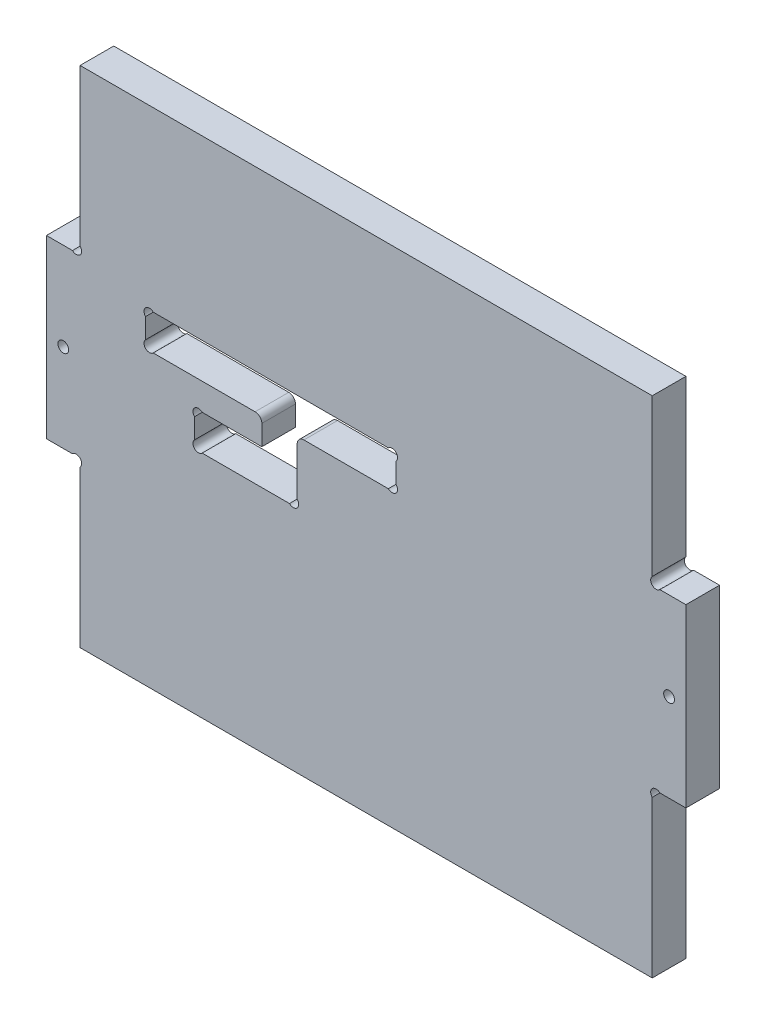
SolidWorks part; units mm, degrees
ref_plane "Plan de face" through (0, 0, 0) normal (0, 0, 1) x (1, 0, 0)
ref_plane "Plan de dessus" through (0, 0, 0) normal (0, 1, 0) x (1, 0, 0)
ref_plane "Plan de droite" through (0, 0, 0) normal (1, 0, 0) x (0, 0, -1)
sketch "Esquisse1" plane through (0, 0, 0) normal (0, 0, 1) x (1, 0, 0)
  line L0 (95, 41.9079) -> (95, 51.9079)
  line L1 (-20.5, -29.7114) -> (-29.2069, -21.2314) construction
  line L2 (-95, 41.9079) -> (-95, -97.9114)
  line L3 (-95, -97.9114) -> (95, -97.9114)
  line L4 (95, 41.9079) -> (95, -97.9114)
  line L7 (-31, -0.7114) -> (-20.5, -0.7114)
  line L8 (-31, -0.7114) -> (-31, -29.7114)
  line L9 (-31, -29.7114) -> (-22.7924, -29.7114)
  line L10 (-20.5, -0.7114) -> (-20.5, -27.4788)
  line L13 (0, 68.0403) -> (0, -120.1787) construction
  line L17 (95, 51.9079) -> (-95, 51.9079)
  line L18 (-95, 41.9079) -> (-95, 51.9079)
  arc A0 (-22.7924, -29.7114) -> (-20.5, -27.4788) centre (-21.6462, -28.5951) ccw
  point P0 (0, 0)
  point P14 (-21.6462, -28.5951)
  dimension "D1" = 190
  dimension "D2" = 139.8194
  dimension "D3" = 10.5
  dimension "D4" = 64
  dimension "D5" = 1.6
  dimension "D6" = 29
  dimension "D7" = 68.2
extrude "Boss.-Extru.1" add sketch "Esquisse1" along normal blind 10
sketch "Esquisse14" plane through (0, 0, 10) normal (0, 0, 1) x (1, 0, 0)
  line L0 (0, 106.416) -> (0, -108.7689) construction
  line L1 (95, -23.0018) -> (-170.2302, -23.0018) construction
  line L2 (95, -97.9114) -> (95, 51.9079) construction
  line L3 (85, 2.7465) -> (98.9726, 16.7191) construction
  line L4 (-85, 2.7465) -> (-98.9726, 16.7191) construction
  line L5 (85, 51.9079) -> (85, 5.4207)
  line L6 (-85, -48.75) -> (-98.9726, -62.7226) construction
  line L7 (-85, -97.9114) -> (-85, -51.4242)
  line L8 (-95, -49.1614) -> (-87.2627, -49.1614)
  line L9 (-95, -97.9114) -> (-95, -49.1614)
  line L10 (-95, -97.9114) -> (-85, -97.9114)
  line L11 (95, 3.1579) -> (87.2627, 3.1579)
  line L12 (85, -48.75) -> (98.9726, -62.7226) construction
  line L13 (95, -97.9114) -> (85, -97.9114)
  line L14 (95, -97.9114) -> (95, -49.1614)
  line L15 (95, -49.1614) -> (87.2627, -49.1614)
  line L16 (85, -97.9114) -> (85, -51.4242)
  line L17 (95, 51.9079) -> (95, 3.1579)
  line L18 (95, 51.9079) -> (85, 51.9079)
  line L19 (-95, 51.9079) -> (-85, 51.9079)
  line L20 (-95, 51.9079) -> (-95, 3.1579)
  line L21 (-95, 3.1579) -> (-87.2627, 3.1579)
  line L22 (-85, 51.9079) -> (-85, 5.4207)
  line L23 (95, 51.9079) -> (-95, 51.9079) construction
  arc A0 (85, 5.4207) -> (87.2627, 3.1579) centre (86.1314, 4.2893) ccw
  arc A1 (-85, -51.4242) -> (-87.2627, -49.1614) centre (-86.1314, -50.2928) ccw
  arc A2 (85, -51.4242) -> (87.2627, -49.1614) centre (86.1314, -50.2928) cw
  arc A3 (-85, 5.4207) -> (-87.2627, 3.1579) centre (-86.1314, 4.2893) cw
  dimension "D1" = 0
extrude "Enlèv. mat.-Extru.9" cut sketch "Esquisse14" against normal through all
sketch "Esquisse16" plane through (0, 0, 10) normal (0, 0, 1) x (1, 0, 0)
  line L0 (-58.2793, -0.7114) -> (-63.2773, -0.7114)
  line L1 (-70.54, -5.9614) -> (19.2239, -5.9614) construction
  line L2 (-20.5, -0.7114) -> (6.5833, -0.7114)
  line L3 (-20.5, -0.7114) -> (-20.5, -11.2114)
  line L4 (-20.5, -11.2114) -> (6.5833, -11.2114)
  line L5 (8.84, -2.9802) -> (8.84, -8.9427)
  line L6 (-31, -0.7114) -> (-58.2793, -0.7114)
  line L7 (-31, -0.7114) -> (-31, -11.2114)
  line L8 (-31, -11.2114) -> (-58.2793, -11.2114)
  line L9 (-65.54, -2.9742) -> (-65.54, -8.9487)
  line L10 (-65.54, -11.2114) -> (-61.8893, -7.5607) construction
  line L11 (8.84, -11.2114) -> (5.7464, -8.1013) construction
  line L12 (-58.2793, -11.2114) -> (-63.2773, -11.2114)
  line L14 (-65.54, -0.7114) -> (-63.2773, -2.9742) construction
  arc A0 (-63.2773, -0.7114) -> (-65.54, -2.9742) centre (-64.4086, -1.8428) ccw
  arc A1 (-65.54, -8.9487) -> (-63.2773, -11.2114) centre (-64.4086, -10.0801) ccw
  arc A2 (8.84, -8.9427) -> (6.5833, -11.2114) centre (7.7116, -10.0771) cw
  arc A3 (8.84, -2.9802) -> (6.5833, -0.7114) centre (7.7116, -1.8458) ccw
  point P7 (7.7116, -10.0771)
  point P11 (-64.4086, -1.8428)
  point P14 (-64.4086, -10.0801)
  dimension "D3" = 34.54
  dimension "D4" = 1.6
  dimension "D1" = 1.6
  dimension "D2" = 1.6
extrude "Enlèv. mat.-Extru.11" cut sketch "Esquisse16" against normal through all
sketch "Esquisse17" plane through (0, 0, 10) normal (0, 0, 1) x (1, 0, 0)
  line L0 (-51, -24.4614) -> (-27.6487, -24.4614) construction
  line L1 (-51, -29.7114) -> (-48.1374, -26.8433) construction
  line L2 (-31, -29.7114) -> (-48.7395, -29.7114)
  line L3 (-31, -29.7114) -> (-31, -19.2114)
  line L4 (-31, -19.2114) -> (-48.7395, -19.2114)
  line L5 (-51, -27.4465) -> (-51, -21.4764)
  arc A0 (-51, -27.4465) -> (-48.7395, -29.7114) centre (-49.8697, -28.579) ccw
  arc A1 (-51, -21.4764) -> (-48.7395, -19.2114) centre (-49.8697, -20.3439) cw
  point P6 (-49.8697, -28.579)
  dimension "D3" = 1.6
extrude "Enlèv. mat.-Extru.12" cut sketch "Esquisse17" against normal through all
fillet "Congé1" radius 2 2 edges at (-20.5, -11.2114, 5) (-31, -11.2114, 5)
sketch "Esquisse20" plane through (0, 0, 0) normal (0, 0, -1) x (-1, 0, 0)
  line L0 (-85, 48.75) -> (-85, -48.75) construction
  line L1 (-85, -48.75) -> (-95, 48.75) construction
  line L5 (-105.6431, 0) -> (127.6965, 0) construction
  line L6 (87.2627, -49.1614) -> (95, -49.1614) construction
  circle A0 centre (-90, -23.0014) radius 1.6
  circle A1 centre (90, -23.0014) radius 1.6
  dimension "D1" = 26.16
extrude "Enlèv. mat.-Extru.15" cut sketch "Esquisse20" against normal through all
sketch "Esquisse21" plane through (0, 0, 0) normal (0, 0, -1) x (-1, 0, 0)
  line L0 (6.0004, -66.7294) -> (6.0004, -93.5153) construction
  line L1 (3.2645, -66.7294) -> (8.7364, -66.7294)
  line L2 (1, -68.9904) -> (1, -90.6515)
  line L3 (3.2645, -92.9125) -> (8.7364, -92.9125)
  line L4 (11.0009, -68.9904) -> (11.0009, -90.6515)
  line L5 (1, -79.8209) -> (13.6676, -79.8209) construction
  line L6 (1, -66.7294) -> (4.0383, -69.763) construction
  arc A0 (3.2645, -66.7294) -> (1, -68.9904) centre (2.1322, -67.8599) ccw
  arc A1 (8.7364, -66.7294) -> (11.0009, -68.9904) centre (9.8687, -67.8599) cw
  arc A2 (8.7364, -92.9125) -> (11.0009, -90.6515) centre (9.8687, -91.782) ccw
  arc A3 (3.2645, -92.9125) -> (1, -90.6515) centre (2.1322, -91.782) cw
  point P8 (2.1322, -67.8599)
  dimension "D1" = 1.6
extrude "Enlèv. mat.-Extru.16" cut sketch "Esquisse21" against normal blind 5
